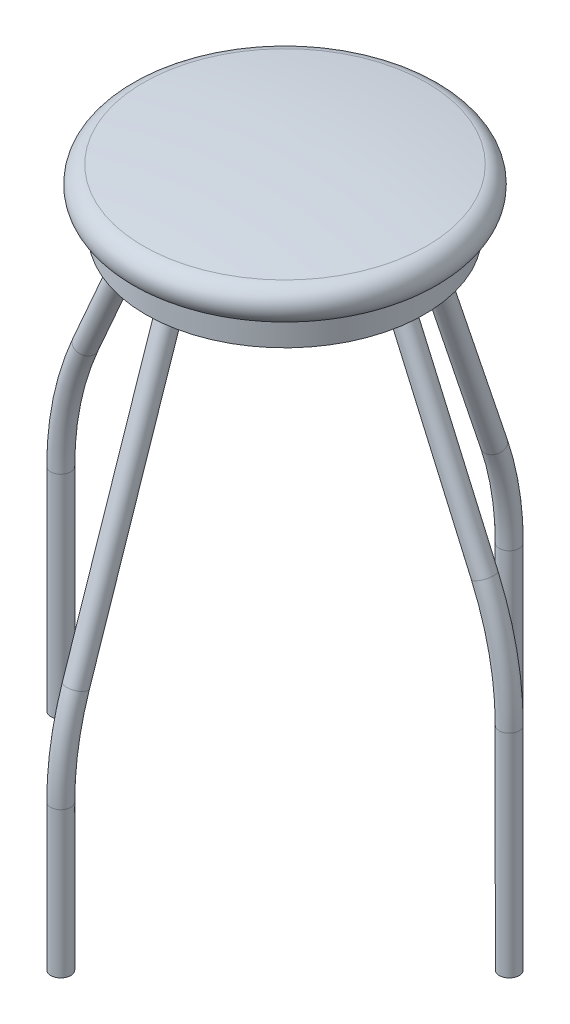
SolidWorks part; units mm, degrees
ref_plane "Front" through (0, 0, 0) normal (0, 0, 1) x (1, 0, 0)
ref_plane "Top" through (0, 0, 0) normal (0, 1, 0) x (1, 0, 0)
ref_plane "Right" through (0, 0, 0) normal (1, 0, 0) x (0, 0, -1)
sketch "Sketch2" plane through (0, 0, 0) normal (0, 0, 1) x (1, 0, 0)
  line L0 (0, 0) -> (0, 129.8382) construction
  line L1 (0, 0) -> (183.6383, 0)
  line L2 (183.6383, 34.5699) -> (183.6383, 0)
  line L3 (0, 92.1797) -> (207.5723, 92.1797) construction
  line L15 (0, 92.1797) -> (0, 0)
  arc A0 (183.6383, 34.5699) -> (186.6672, 79.6333) centre (183.6383, 57.2034) ccw
  arc A1 (186.6672, 79.6333) -> (0, 92.1797) centre (0, -1302.7225) ccw
  dimension "D3" = 1394.9022
  dimension "D4" = 22.6335
  dimension "D1" = 92.1797
  dimension "D2" = 183.6383
revolve "Revolve1" add sketch "Sketch2" angle 360 about L0
sketch "Sketch3" plane through (0, 0, 0) normal (0, -1, 0) x (1, 0, 0)
  circle A0 centre (0, 0) radius 162.1425
extrude "Cut-Extrude1" cut sketch "Sketch3" against normal blind 43.18
ref_plane "Plane1" through (0, -692.085, 0) normal (0, 1, 0) x (-1, 0, 0)
sketch "Sketch10" plane through (0, 0, 0) normal (0, 0, 1) x (1, 0, 0)
  line L0 (0, 0) -> (0, -692.085) construction
  line L1 (356.2833, -692.085) -> (-356.2833, -692.085) construction
sketch "Sketch11" plane through (0, 0, 0) normal (0, 0, 1) x (1, 0, 0)
  line L0 (-295.5693, -692.085) -> (-295.5693, -412.685)
  line L1 (356.2833, -692.085) -> (-356.2833, -692.085) construction
  line L2 (-263.0697, -257.652) -> (-145.6078, 10.2009)
  line L3 (-122.3462, 25.4) -> (122.3462, 25.4)
  line L6 (0, 0) -> (0, -692.085) construction
  line L7 (295.5693, -692.085) -> (295.5693, -412.685)
  line L8 (263.0697, -257.652) -> (145.6078, 10.2009)
  arc A0 (-295.5693, -412.685) -> (-263.0697, -257.652) centre (90.458, -412.685) cw
  arc A1 (295.5693, -412.685) -> (263.0697, -257.652) centre (-90.458, -412.685) ccw
  arc A2 (-145.6078, 10.2009) -> (-122.3462, 25.4) centre (-122.3462, 0) cw
  arc A3 (145.6078, 10.2009) -> (122.3462, 25.4) centre (122.3462, 0) ccw
  point P20 (-138.9426, 25.4)
  point P23 (138.9426, 25.4)
  dimension "D1" = 25.4
  dimension "D2" = 591.1385
  dimension "D5" = 386.0272
  dimension "D6" = 279.4
  dimension "D3" = 717.485
  dimension "D4" = 244.6925
sketch "Sketch12" plane through (0, -692.085, 0) normal (0, 1, 0) x (-1, 0, 0)
  circle A0 centre (295.5693, 0) radius 13.0562
  circle A1 centre (295.5693, 0) radius 10.5162
  dimension "D1" = 26.1124
  dimension "D2" = 2.54
sweep "Sweep4" add profiles "Sketch12" path "Sketch11"
sketch "Sketch13" plane through (0, 0, 0) normal (1, 0, 0) x (0, 0, -1)
  line L0 (-295.5693, -692.085) -> (-295.5693, -500.071)
  line L2 (-275.5771, -377.4522) -> (-146.4308, 8.0681)
  line L3 (-122.3462, 25.4) -> (122.3462, 25.4)
  line L6 (0, 0) -> (0, -692.085) construction
  line L7 (295.5693, -692.085) -> (295.5693, -500.071)
  line L8 (275.5771, -377.4522) -> (146.4308, 8.0681)
  arc A0 (-295.5693, -500.071) -> (-275.5771, -377.4522) centre (90.458, -500.071) cw
  arc A1 (295.5693, -500.071) -> (275.5771, -377.4522) centre (-90.458, -500.071) ccw
  arc A2 (-146.4308, 8.0681) -> (-122.3462, 25.4) centre (-122.3462, 0) cw
  arc A3 (146.4308, 8.0681) -> (122.3462, 25.4) centre (122.3462, 0) ccw
  point P20 (-140.6248, 25.4)
  point P23 (140.6248, 25.4)
  dimension "D1" = 25.4
  dimension "D2" = 25.4
sketch "Sketch14" plane through (0, -692.085, 0) normal (0, 1, 0) x (-1, 0, 0)
  circle A0 centre (0, 295.5693) radius 13.0562
  circle A1 centre (0, 295.5693) radius 10.5162
  dimension "D1" = 2.54
  dimension "D2" = 26.1124
sweep "Sweep5" add profiles "Sketch14" path "Sketch13"
ref_point "Point1"
ref_point "Point2"
ref_point "Point3"
ref_point "Point4"
sketch "Sketch15" plane through (0, -692.085, 0) normal (0, -1, 0) x (1, 0, 0)
  line L0 (-308.6255, 0) -> (-295.5693, 0)
  line L1 (-295.5693, 0) -> (-295.5693, -13.0562)
  circle A0 centre (-295.5693, 0) radius 13.0562 construction
  arc A1 (-308.6255, 0) -> (-295.5693, -13.0562) centre (-295.5693, 0) ccw
sketch "Sketch16" [suppressed] plane through (0, -692.085, 0) normal (0, -1, 0) x (1, 0, 0)
  line L0 (-13.9602, 295.5693) -> (0, 295.5693)
  line L1 (0, 295.5693) -> (0, 281.6091)
  circle A1 centre (0, 295.5693) radius 13.9602
  arc A2 (-13.9602, 295.5693) -> (0, 281.6091) centre (0, 295.5693) ccw
  dimension "D1" = 0
sketch "Sketch17" plane through (0, -692.085, 0) normal (0, -1, 0) x (1, 0, 0)
  line L0 (-13.9602, -295.5693) -> (0, -295.5693)
  line L1 (0, -295.5693) -> (0, -309.5294)
  circle A1 centre (0, -295.5693) radius 13.9602
  arc A2 (-13.9602, -295.5693) -> (0, -309.5294) centre (0, -295.5693) ccw
  dimension "D1" = 0
sketch "Sketch18" plane through (0, -692.085, 0) normal (0, -1, 0) x (1, 0, 0)
  line L0 (282.5131, 0) -> (295.5693, 0)
  line L1 (295.5693, 0) -> (295.5693, -13.0562)
  circle A1 centre (295.5693, 0) radius 13.0562
  arc A2 (282.5131, 0) -> (295.5693, -13.0562) centre (295.5693, 0) ccw
  dimension "D1" = 0
